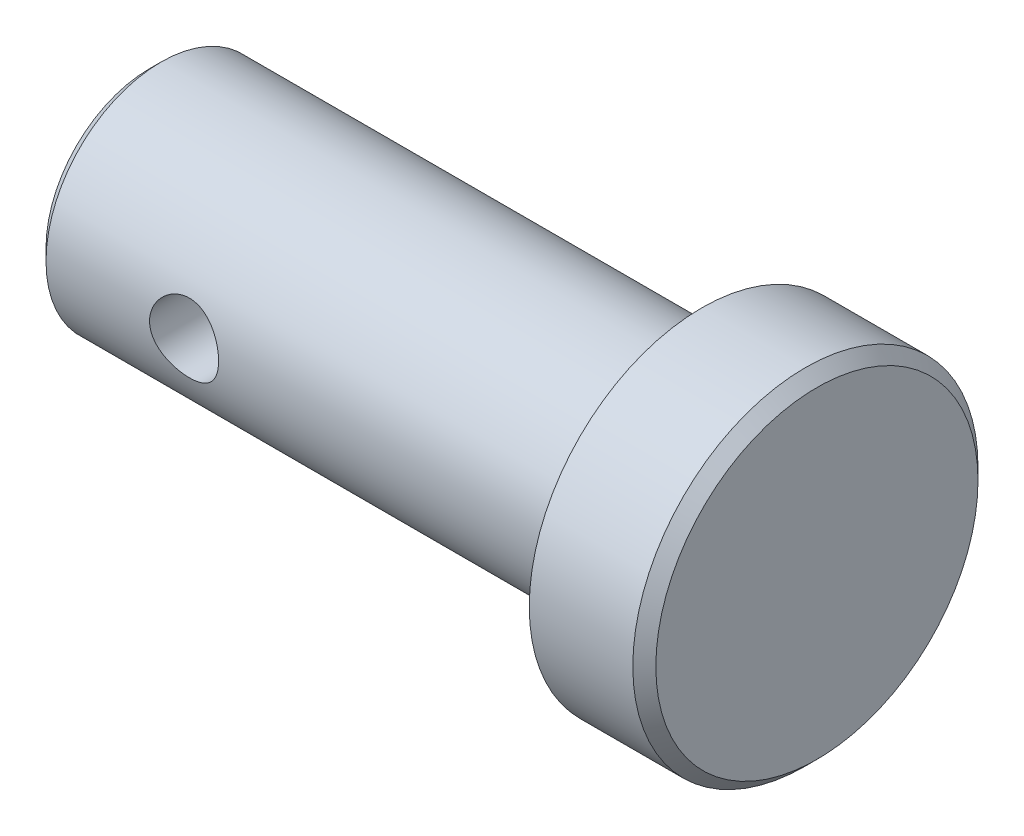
SolidWorks part; units mm, degrees
ref_plane "Front Plane" through (0, 0, 0) normal (0, 0, 1) x (1, 0, 0)
ref_plane "Top Plane" through (0, 0, 0) normal (0, 1, 0) x (1, 0, 0)
ref_plane "Right Plane" through (0, 0, 0) normal (1, 0, 0) x (0, 0, -1)
sketch "Sketch1" plane through (0, 0, 0) normal (1, 0, 0) x (0, 0, -1)
  circle A0 centre (0, 0) radius 15
  dimension "D1" = 30
extrude "Boss-Extrude1" add sketch "Sketch1" along normal blind 10 from offset 2
sketch "Sketch2" plane through (2, 0, 0) normal (-1, 0, 0) x (0, 0, 1)
  circle A0 centre (0, 0) radius 10
  dimension "D1" = 20
extrude "Boss-Extrude2" add sketch "Sketch2" along normal blind 48
chamfer "Chamfer2" distance 1 angle 45 2 edges at (-46, 0, 10) (12, 0, -15)
sketch "Sketch3" plane through (0, 0, 0) normal (0, 0, 1) x (1, 0, 0)
  line L2 (2, 10) -> (-45, 10) construction
  circle A0 centre (-33, 0) radius 3
  dimension "D2" = 6
  dimension "D1" = 10
extrude "Cut-Extrude1" cut sketch "Sketch3" against normal mid plane 48
